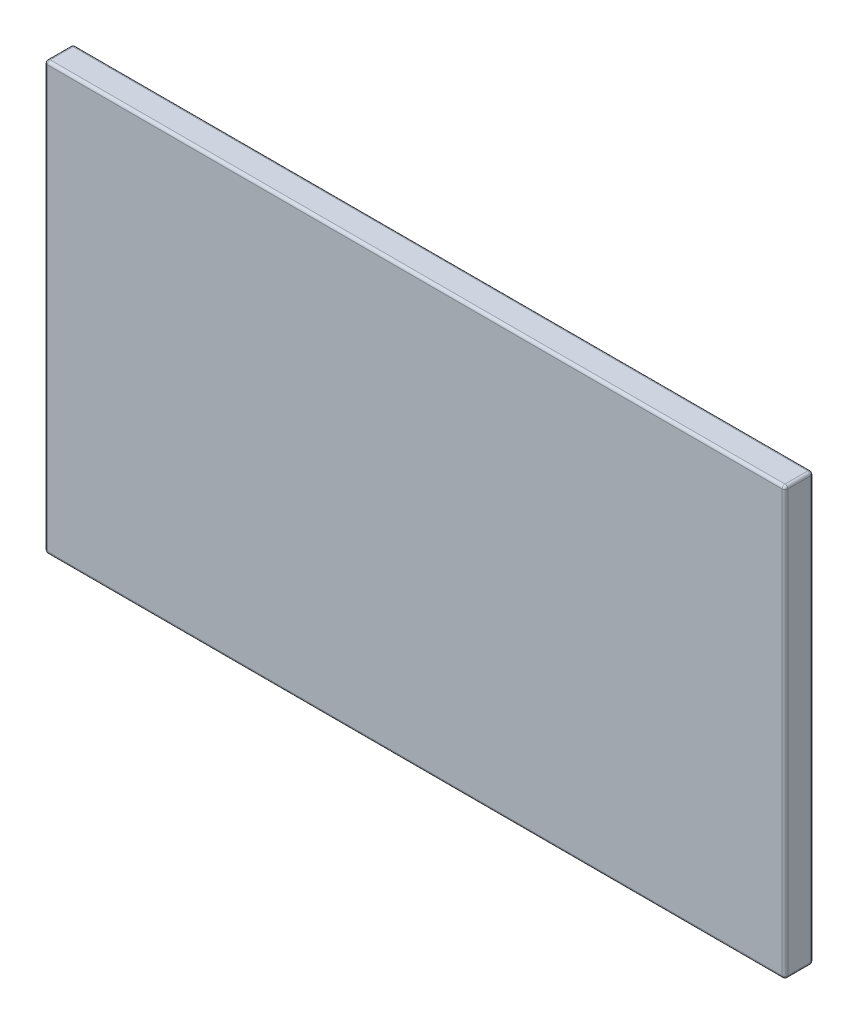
SolidWorks part; units mm, degrees
ref_plane "Ebene vorne" through (0, 0, 0) normal (0, 0, 1) x (1, 0, 0)
ref_plane "Ebene oben" through (0, 0, 0) normal (0, 1, 0) x (1, 0, 0)
ref_plane "Ebene rechts" through (0, 0, 0) normal (1, 0, 0) x (0, 0, -1)
sketch "Skizze1" plane through (0, 0, 0) normal (0, 0, 1) x (1, 0, 0)
  line L1 (-650, -375) -> (650, -375)
  line L2 (-650, -375) -> (-650, 375)
  line L3 (-650, 375) -> (650, 375)
  line L4 (650, -375) -> (650, 375)
  line L5 (-650, -375) -> (650, 375) construction
  line L6 (-650, 375) -> (650, -375) construction
  point P0 (0, 0)
  dimension "D1" = 750
  dimension "D2" = 1300
extrude "Aufsatz-Linear austragen1" add sketch "Skizze1" along normal blind 50
fillet "Verrundung1" radius 5 12 edges at (0, 375, 0) (-650, 375, 25) (-650, 0, 0) (-650, -375, 25) (0, -375, 0) (650, 0, 0) (650, -375, 25) (650, 375, 25) (650, 0, 50) (0, 375, 50) (-650, 0, 50) (0, -375, 50)
